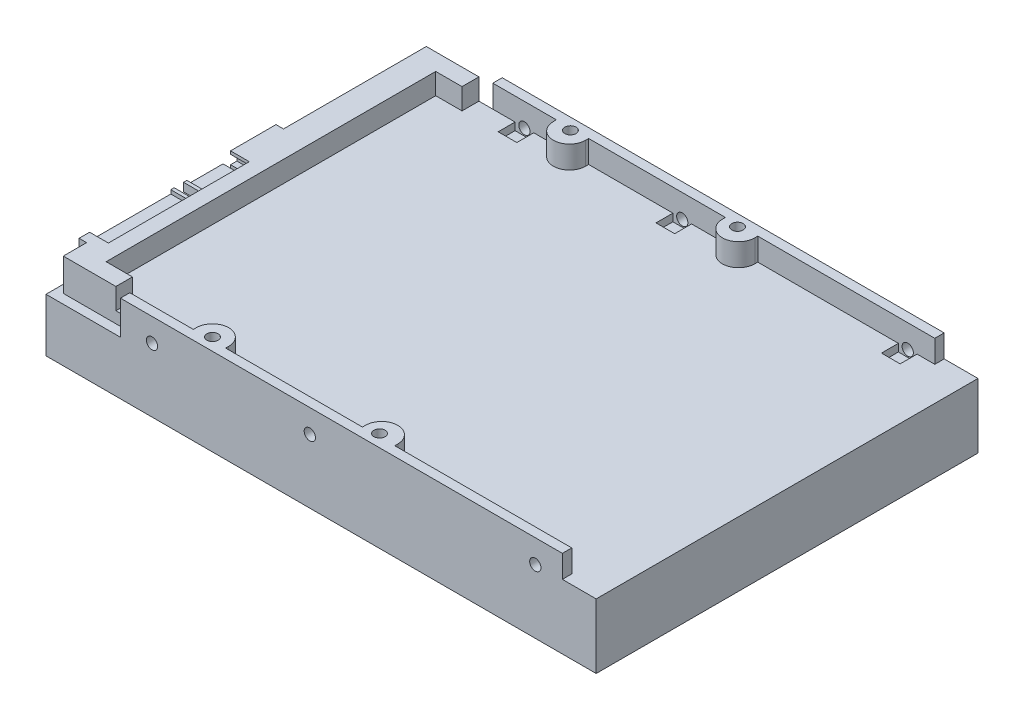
SolidWorks part; units mm, degrees
ref_plane "前视基准面" through (0, 0, 0) normal (0, 0, 1) x (1, 0, 0)
ref_plane "上视基准面" through (0, 0, 0) normal (0, 1, 0) x (1, 0, 0)
ref_plane "右视基准面" through (0, 0, 0) normal (1, 0, 0) x (0, 0, -1)
ref_plane "Plane1" through (0, 29.85, 0) normal (0, 1, 0) x (1, 0, 0)
sketch "Sketch1" plane through (0, 29.85, 0) normal (0, 1, 0) x (1, 0, 0)
  line L0 (74.05, 56.05) -> (-63.35, 56.05)
  line L1 (-63.35, 56.05) -> (-63.35, -45.55)
  line L2 (-63.35, -45.55) -> (74.05, -45.55)
  line L3 (74.05, -45.55) -> (74.05, 56.05)
extrude "Boss-Extrude1" add sketch "Sketch1" against normal blind 17.2
sketch "Sketch2" plane through (0, 0, 45.55) normal (0, 0, 1) x (1, 0, 0)
  line L0 (-63.35, 26.85) -> (-61.25, 26.85)
  line L1 (-61.25, 26.85) -> (-61.25, 29.85)
  line L2 (-61.25, 29.85) -> (-63.35, 29.85)
  line L3 (-63.35, 29.85) -> (-63.35, 26.85)
extrude "Cut-Extrude1" cut sketch "Sketch2" against normal through all
sketch "Sketch3" plane through (0, 29.85, 0) normal (0, 1, 0) x (-1, 0, 0)
  line L0 (43.55, 45.55) -> (43.55, 43.05)
  line L1 (43.55, 43.05) -> (61.25, 43.05)
  line L2 (61.25, 43.05) -> (61.25, 45.55)
  line L3 (61.25, 45.55) -> (43.55, 45.55)
extrude "Cut-Extrude2" cut sketch "Sketch3" against normal blind 3
sketch "Sketch4" plane through (0, 29.85, 0) normal (0, 1, 0) x (-1, 0, 0)
  line L0 (-74.05, 43.05) -> (-74.05, 45.55)
  line L1 (-74.05, 45.55) -> (43.55, 45.55)
  line L2 (43.55, 45.55) -> (43.55, 43.05)
  line L3 (43.55, 43.05) -> (-74.05, 43.05)
extrude "Boss-Extrude2" add sketch "Sketch4" along normal blind 6
sketch "Sketch5" plane through (0, 29.85, 0) normal (0, 1, 0) x (-1, 0, 0)
  line L0 (61.25, -56.05) -> (61.25, -53.55)
  line L1 (61.25, -53.55) -> (43.55, -53.55)
  line L2 (43.55, -53.55) -> (43.55, -56.05)
  line L3 (43.55, -56.05) -> (61.25, -56.05)
extrude "Cut-Extrude3" cut sketch "Sketch5" against normal blind 3
sketch "Sketch6" plane through (0, 29.85, 0) normal (0, 1, 0) x (-1, 0, 0)
  line L0 (61.25, 43.05) -> (61.25, -53.55)
  line L1 (61.25, -53.55) -> (47.25, -53.55)
  line L2 (47.25, -53.55) -> (47.25, 43.05)
  line L3 (47.25, 43.05) -> (61.25, 43.05)
extrude "Boss-Extrude3" add sketch "Sketch6" along normal blind 5.6
sketch "Sketch7" plane through (0, 29.85, 0) normal (0, 1, 0) x (-1, 0, 0)
  line L0 (-64.3634, 38.55) -> (-64.3634, 43.05)
  line L1 (-64.3634, 43.05) -> (-69.3366, 43.05)
  line L2 (-69.3366, 43.05) -> (-69.3366, 38.55)
  line L3 (-69.3366, 38.55) -> (-64.3634, 38.55)
extrude "Cut-Extrude4" cut sketch "Sketch7" against normal blind 2
sketch "Sketch8" plane through (0, 29.85, 0) normal (0, 1, 0) x (-1, 0, 0)
  line L0 (-4.3634, 38.55) -> (-4.3634, 43.05)
  line L1 (-4.3634, 43.05) -> (-9.3366, 43.05)
  line L2 (-9.3366, 43.05) -> (-9.3366, 38.55)
  line L3 (-9.3366, 38.55) -> (-4.3634, 38.55)
extrude "Cut-Extrude5" cut sketch "Sketch8" against normal blind 2
sketch "Sketch9" plane through (0, 29.85, 0) normal (0, 1, 0) x (-1, 0, 0)
  line L0 (32.6634, 38.55) -> (37.6366, 38.55)
  line L1 (37.6366, 38.55) -> (37.6366, 43.05)
  line L2 (37.6366, 43.05) -> (32.6634, 43.05)
  line L3 (32.6634, 43.05) -> (32.6634, 38.55)
extrude "Cut-Extrude6" cut sketch "Sketch9" against normal blind 2
sketch "Sketch10" plane through (74.05, 0, 0) normal (1, 0, 0) x (0, 0, -1)
  line L0 (56.05, 12.65) -> (-45.55, 12.65)
  line L1 (-45.55, 12.65) -> (-45.55, 29.85)
  line L2 (-45.55, 29.85) -> (56.05, 29.85)
  line L3 (56.05, 29.85) -> (56.05, 12.65)
extrude "Boss-Extrude4" add sketch "Sketch10" along normal blind 9
ref_plane "Plane2" through (0, 0, -56.05) normal (0, 0, -1) x (-1, 0, 0)
sketch "Sketch11" plane through (0, 0, -56.05) normal (0, 0, -1) x (-1, 0, 0)
  line L0 (43.55, 29.85) -> (43.55, 35.85)
  line L1 (43.55, 35.85) -> (-74.05, 35.85)
  line L2 (-74.05, 35.85) -> (-74.05, 29.85)
  line L3 (-74.05, 29.85) -> (43.55, 29.85)
extrude "Boss-Extrude5" add sketch "Sketch11" against normal blind 2.5
sketch "Sketch12" plane through (0, 29.85, 0) normal (0, 1, 0) x (-1, 0, 0)
  line L0 (37.6366, -49.05) -> (32.6634, -49.05)
  line L1 (32.6634, -49.05) -> (32.6634, -53.55)
  line L2 (32.6634, -53.55) -> (37.6366, -53.55)
  line L3 (37.6366, -53.55) -> (37.6366, -49.05)
extrude "Cut-Extrude7" cut sketch "Sketch12" against normal blind 2
sketch "Sketch13" plane through (0, 29.85, 0) normal (0, 1, 0) x (-1, 0, 0)
  line L0 (-4.3634, -49.05) -> (-9.3366, -49.05)
  line L1 (-9.3366, -49.05) -> (-9.3366, -53.55)
  line L2 (-9.3366, -53.55) -> (-4.3634, -53.55)
  line L3 (-4.3634, -53.55) -> (-4.3634, -49.05)
extrude "Cut-Extrude8" cut sketch "Sketch13" against normal blind 2
sketch "Sketch14" plane through (0, 29.85, 0) normal (0, 1, 0) x (-1, 0, 0)
  line L0 (-64.3634, -49.05) -> (-69.3366, -49.05)
  line L1 (-69.3366, -49.05) -> (-69.3366, -53.55)
  line L2 (-69.3366, -53.55) -> (-64.3634, -53.55)
  line L3 (-64.3634, -53.55) -> (-64.3634, -49.05)
extrude "Cut-Extrude9" cut sketch "Sketch14" against normal blind 2
sketch "Sketch15" plane through (-61.25, 0, 0) normal (-1, 0, 0) x (0, 0, 1)
  line L0 (-3.45, 35.45) -> (-3.45, 29.75)
  line L1 (-3.45, 29.75) -> (34.05, 29.75)
  line L2 (34.05, 29.75) -> (34.05, 35.45)
  line L3 (34.05, 35.45) -> (-3.45, 35.45)
extrude "Cut-Extrude10" cut sketch "Sketch15" against normal blind 3
sketch "Sketch16" plane through (-61.25, 0, 0) normal (-1, 0, 0) x (0, 0, 1)
  line L0 (34.05, 31.45) -> (34.05, 35.45)
  line L1 (34.05, 35.45) -> (36.85, 35.45)
  line L2 (36.85, 35.45) -> (36.85, 31.45)
  line L3 (36.85, 31.45) -> (34.05, 31.45)
extrude "Boss-Extrude6" add sketch "Sketch16" along normal blind 2
sketch "Sketch17" plane through (0, 0, 34.05) normal (0, 0, -1) x (-1, 0, 0)
  line L0 (58.25, 34.65) -> (58.25, 32.25)
  line L1 (58.25, 32.25) -> (63.25, 32.25)
  line L2 (63.25, 32.25) -> (63.25, 34.65)
  line L3 (63.25, 34.65) -> (58.25, 34.65)
extrude "Cut-Extrude11" cut sketch "Sketch17" against normal blind 2
sketch "Sketch18" plane through (-61.25, 0, 0) normal (-1, 0, 0) x (0, 0, 1)
  line L0 (-3.45, 35.45) -> (-3.45, 31.45)
  line L1 (-3.45, 31.45) -> (-15.55, 31.45)
  line L2 (-15.55, 31.45) -> (-15.55, 35.45)
  line L3 (-15.55, 35.45) -> (-3.45, 35.45)
extrude "Boss-Extrude7" add sketch "Sketch18" along normal blind 2
sketch "Sketch19" plane through (-63.25, 0, 0) normal (-1, 0, 0) x (0, 0, 1)
  line L0 (-5.15, 34.65) -> (-5.15, 32.25)
  line L1 (-5.15, 32.25) -> (-3.45, 32.25)
  line L2 (-3.45, 32.25) -> (-3.45, 34.65)
  line L3 (-3.45, 34.65) -> (-5.15, 34.65)
extrude "Cut-Extrude12" cut sketch "Sketch19" against normal blind 5
sketch "Sketch20" plane through (0, 35.45, 0) normal (0, 1, 0) x (-1, 0, 0)
  line L0 (54.25, -49.05) -> (54.25, 38.65)
  line L1 (54.25, 38.65) -> (47.25, 38.65)
  line L2 (47.25, 38.65) -> (47.25, -49.05)
  line L3 (47.25, -49.05) -> (54.25, -49.05)
extrude "Cut-Extrude13" cut sketch "Sketch20" against normal blind 5.6
sketch "Sketch21" plane through (0, 29.85, 0) normal (0, 1, 0) x (-1, 0, 0)
  line L0 (26.65, -53.55) -> (18.05, -53.55)
  line L1 (18.05, -53.55) -> (18.05, -52.75)
  line L2 (26.65, -52.75) -> (26.65, -53.55)
  arc A0 (18.05, -52.75) -> (26.65, -52.75) centre (22.35, -52.75) cw
extrude "Boss-Extrude8" add sketch "Sketch21" along normal blind 6
sketch "Sketch22" plane through (0, 29.85, 0) normal (0, 1, 0) x (-1, 0, 0)
  line L0 (-18.35, -53.55) -> (-26.95, -53.55)
  line L1 (-26.95, -53.55) -> (-26.95, -52.75)
  line L2 (-18.35, -52.75) -> (-18.35, -53.55)
  arc A0 (-26.95, -52.75) -> (-18.35, -52.75) centre (-22.65, -52.75) cw
extrude "Boss-Extrude9" add sketch "Sketch22" along normal blind 6
sketch "Sketch23" plane through (0, 29.85, 0) normal (0, 1, 0) x (-1, 0, 0)
  line L0 (-26.95, 43.05) -> (-18.35, 43.05)
  line L1 (-18.35, 43.05) -> (-18.35, 42.25)
  line L2 (-26.95, 42.25) -> (-26.95, 43.05)
  arc A0 (-18.35, 42.25) -> (-26.95, 42.25) centre (-22.65, 42.25) cw
extrude "Boss-Extrude10" add sketch "Sketch23" along normal blind 6
sketch "Sketch24" plane through (0, 29.85, 0) normal (0, 1, 0) x (-1, 0, 0)
  line L0 (18.05, 43.05) -> (26.65, 43.05)
  line L1 (26.65, 43.05) -> (26.65, 42.25)
  line L2 (18.05, 42.25) -> (18.05, 43.05)
  arc A0 (26.65, 42.25) -> (18.05, 42.25) centre (22.35, 42.25) cw
extrude "Boss-Extrude11" add sketch "Sketch24" along normal blind 6
sketch "Sketch25" plane through (0, 12.65, 0) normal (0, -1, 0) x (1, 0, 0)
  line L0 (62.05, 42.35) -> (79.75, 24.55)
  line L1 (79.75, 24.55) -> (79.75, -35.05)
  line L2 (79.75, -35.05) -> (62.05, -52.85)
  line L3 (62.05, -52.85) -> (30.8853, -52.85)
  line L4 (30.8853, -52.85) -> (3.2424, -46.0898)
  line L5 (-4.6609, -52.85) -> (-42.35, -52.85)
  line L6 (-42.35, -52.85) -> (-60.05, -35.05)
  line L7 (-60.05, -35.05) -> (-60.05, 24.55)
  line L8 (-60.05, 24.55) -> (-42.35, 42.35)
  line L9 (-42.35, 42.35) -> (-8.9948, 42.35)
  line L10 (2.9948, 42.35) -> (62.05, 42.35)
  arc A0 (3.2424, -46.0898) -> (-4.6609, -52.85) centre (-4.6609, -44.85) cw
  arc A1 (-8.9948, 42.35) -> (2.9948, 42.35) centre (-3, 42.6) ccw
extrude "Boss-Extrude12" add sketch "Sketch25" along normal blind 3
sketch "Sketch26" plane through (-58.25, 0, 0) normal (-1, 0, 0) x (0, 0, 1)
  line L0 (12.45, 34.45) -> (12.45, 33.45)
  line L1 (12.45, 33.45) -> (32.05, 33.45)
  line L2 (32.05, 33.45) -> (32.05, 32.25)
  line L3 (32.05, 32.25) -> (11.55, 32.25)
  line L4 (11.55, 32.25) -> (11.55, 34.45)
  line L5 (11.55, 34.45) -> (12.45, 34.45)
extrude "Boss-Extrude13" add sketch "Sketch26" along normal blind 5
sketch "Sketch27" plane through (-58.25, 0, 0) normal (-1, 0, 0) x (0, 0, 1)
  line L0 (9.05, 34.45) -> (9.05, 32.25)
  line L1 (9.05, 32.25) -> (-1.45, 32.25)
  line L2 (-1.45, 32.25) -> (-1.45, 33.45)
  line L3 (-1.45, 33.45) -> (8.15, 33.45)
  line L4 (8.15, 33.45) -> (8.15, 34.45)
  line L5 (8.15, 34.45) -> (9.05, 34.45)
extrude "Boss-Extrude14" add sketch "Sketch27" along normal blind 5
sketch "Sketch28" plane through (-63.25, 0, 0) normal (-1, 0, 0) x (0, 0, 1)
  line L0 (-14.65, 32.35) -> (-6.05, 32.35)
  line L1 (-6.05, 32.35) -> (-6.05, 34.55)
  line L2 (-6.05, 34.55) -> (-14.65, 34.55)
  line L3 (-14.65, 34.55) -> (-14.65, 32.35)
extrude "Cut-Extrude14" cut sketch "Sketch28" against normal blind 5
hole_wizard "Ø3.0 (3) Diameter Hole1" positions "Sketch30" profile "Sketch29" hole size "Ø3.0" standard "ANSI Metric"
sketch "Sketch30" plane through (0, 0, -53.55) normal (0, 0, 1) x (1, 0, 0)
  point P0 (-35.15, 29.65)
  point P1 (6.85, 29.65)
  point P2 (66.85, 29.65)
sketch "Sketch29" plane through (-35.15, 29.65, -53.55) normal (1, 0, 0) x (0, -1, 0)
  line L0 (0, 0) -> (0, 2.5)
  line L1 (0, 2.5) -> (1.5, 2.5)
  line L2 (1.5, 2.5) -> (1.5, 0)
  line L5 (1.5, 0) -> (0, 0)
  line L11 (0, -6.35) -> (0, 107.95) construction
  dimension "Thru Hole Dia." = 3
  dimension "Thru Hole Depth" = 2.5
hole_wizard "Ø3.0 (3) Diameter Hole2" positions "Sketch32" profile "Sketch31" hole size "Ø3.0" standard "ANSI Metric"
sketch "Sketch32" plane through (0, 0, 43.05) normal (0, 0, -1) x (-1, 0, 0)
  point P0 (35.15, 29.65)
  point P1 (-6.85, 29.65)
  point P2 (-66.85, 29.65)
sketch "Sketch31" plane through (-35.15, 29.65, 43.05) normal (1, 0, 0) x (0, 1, 0)
  line L0 (0, 0) -> (0, 2.5001)
  line L1 (0, 2.5001) -> (1.5, 2.5001)
  line L2 (1.5, 2.5001) -> (1.5, 0)
  line L5 (1.5, 0) -> (0, 0)
  line L11 (0, -6.35) -> (0, 107.95) construction
  dimension "Thru Hole Dia." = 3
  dimension "Thru Hole Depth" = 2.5
hole_wizard "Ø3.0 (3) Diameter Hole3" positions "Sketch34" profile "Sketch33" hole size "Ø3.0" standard "ANSI Metric"
sketch "Sketch34" plane through (0, 35.85, 0) normal (0, 1, 0) x (1, 0, 0)
  line L1 (-22.35, -42.25) -> (22.1, -42.25)
  line L2 (-22.35, -42.25) -> (-22.35, 53)
  line L3 (-22.35, 53) -> (22.1, 53)
  line L4 (22.1, -42.25) -> (22.1, 53)
  point P0 (-22.35, -42.25)
  point P1 (22.1, -42.25)
  point P2 (-22.35, 53)
  point P3 (22.1, 53)
  dimension "D1" = 95.25
  dimension "D2" = 44.45
sketch "Sketch33" plane through (-22.35, 35.85, 42.25) normal (1, 0, 0) x (0, 0, 1)
  line L0 (0, 0) -> (0, 6)
  line L1 (0, 6) -> (1.5, 6)
  line L2 (1.5, 6) -> (1.5, 0)
  line L5 (1.5, 0) -> (0, 0)
  line L10 (0, 6) -> (-1.5, 6) construction
  line L11 (0, -6.35) -> (0, 107.95) construction
  dimension "Hole Dia." = 3
  dimension "Hole Depth" = 6
  dimension "Drill Angle" = 180
fillet "Fillet1" radius 5 8 edges at (-42.35, 11.15, 42.35) (79.75, 11.15, 24.55) (79.75, 11.15, -35.05) (-42.35, 11.15, -52.85) (62.05, 11.15, 42.35) (-60.05, 11.15, 24.55) (62.05, 11.15, -52.85) (-60.05, 11.15, -35.05)
fillet "Fillet2" radius 6 1 edges at (3.2424, 11.15, -46.0898)
fillet "Fillet3" radius 8 3 edges at (-8.9948, 11.15, 42.35) (2.9948, 11.15, 42.35) (30.8853, 11.15, -52.85)
fillet "Fillet4" radius 1.2 25 edges at (-1.0356, 9.65, -51.9814) (-22.4658, 9.65, -52.85) (4.5904, 9.65, -47.4646) (-42.1906, 9.65, -52.4667) (19.0121, 9.65, -49.9464) (-51.2058, 9.65, -43.9441) (30.8923, 9.65, -52.7925) (-59.6721, 9.65, -34.8941) (45.91, 9.65, -52.85) (-60.05, 9.65, -5.25) (61.8906, 9.65, -52.4667) (-59.6721, 9.65, 24.3941) (70.9058, 9.65, -43.9441) (-51.2058, 9.65, 33.4441) (79.3721, 9.65, -34.8941) (-42.1906, 9.65, 41.9667) (79.75, 9.65, -5.25) (-27.2908, 9.65, 42.35) (79.3721, 9.65, 24.3941) (-10.6856, 9.65, 41.4814) (70.9058, 9.65, 33.4441) (-3, 9.65, 36.6) (61.8906, 9.65, 41.9667) (4.6856, 9.65, 41.4814) (34.1408, 9.65, 42.35)
ref_plane "Plane3" through (0, 9.65, 0) normal (0, -1, 0) x (-1, 0, 0)
